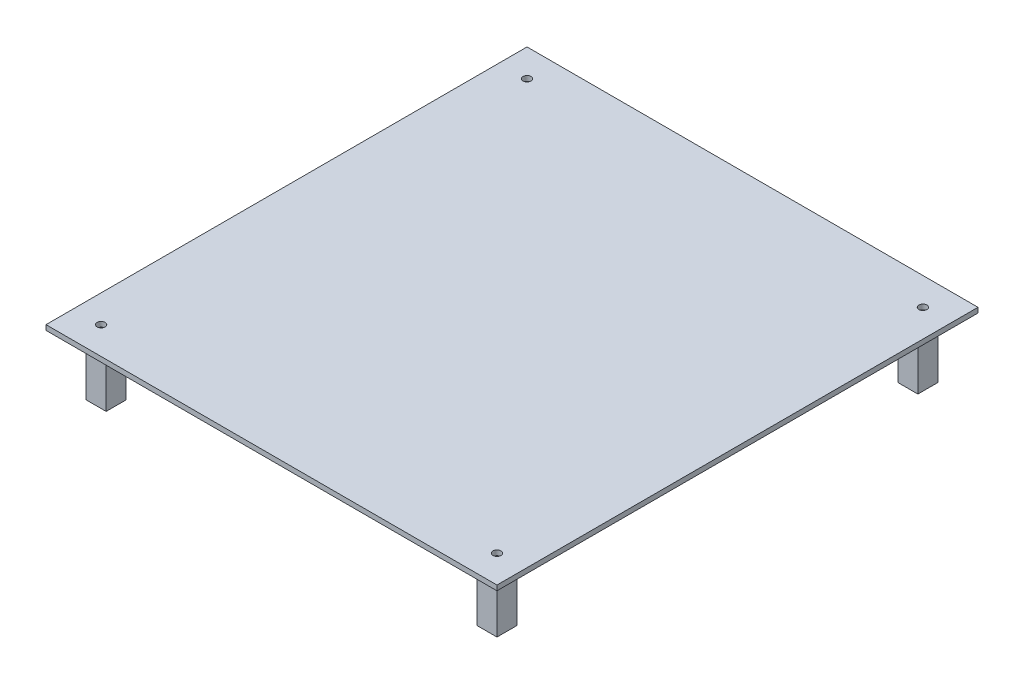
SolidWorks part; units mm, degrees
ref_plane "Front" through (0, 0, 0) normal (0, 0, 1) x (1, 0, 0)
ref_plane "Top" through (0, 0, 0) normal (0, 1, 0) x (1, 0, 0)
ref_plane "Right" through (0, 0, 0) normal (1, 0, 0) x (0, 0, -1)
sketch "Sketch1" plane through (0, 0, 0) normal (0, 1, 0) x (1, 0, 0)
  line L1 (-571.5, -609.6) -> (571.5, -609.6)
  line L2 (-571.5, -609.6) -> (-571.5, 609.6)
  line L3 (-571.5, 609.6) -> (571.5, 609.6)
  line L4 (571.5, -609.6) -> (571.5, 609.6)
  line L5 (-571.5, -609.6) -> (571.5, 609.6) construction
  line L6 (-571.5, 609.6) -> (571.5, -609.6) construction
  point P0 (0, 0)
  dimension "D1" = 1143
  dimension "D2" = 1219.2
extrude "Boss-Extrude1" add sketch "Sketch1" along normal blind 12.7
sketch "Sketch3" plane through (0, 0, 0) normal (0, 0, 1) x (1, 0, 0)
  line L0 (-571.5, 0) -> (571.5, 0) construction
  line L1 (-571.5, 0) -> (-469.9, 0)
  line L2 (-571.5, 0) -> (-571.5, -101.6)
  line L3 (-571.5, -101.6) -> (-469.9, -101.6)
  line L4 (-469.9, 0) -> (-469.9, -101.6)
  line L5 (-565.15, -6.35) -> (-476.25, -6.35)
  line L6 (-565.15, -6.35) -> (-565.15, -95.25)
  line L7 (-565.15, -95.25) -> (-476.25, -95.25)
  line L8 (-476.25, -6.35) -> (-476.25, -95.25)
  line L9 (-50.8, 0) -> (50.8, 0)
  line L10 (-50.8, 0) -> (-50.8, -101.6)
  line L11 (-50.8, -101.6) -> (50.8, -101.6)
  line L12 (50.8, 0) -> (50.8, -101.6)
  line L14 (-44.45, -6.35) -> (44.45, -6.35)
  line L15 (-44.45, -6.35) -> (-44.45, -95.25)
  line L16 (-44.45, -95.25) -> (44.45, -95.25)
  line L17 (44.45, -6.35) -> (44.45, -95.25)
  line L18 (571.5, 0) -> (469.9, 0)
  line L19 (571.5, 0) -> (571.5, -101.6)
  line L20 (571.5, -101.6) -> (469.9, -101.6)
  line L21 (469.9, 0) -> (469.9, -101.6)
  line L22 (476.25, -6.35) -> (565.15, -6.35)
  line L23 (476.25, -6.35) -> (476.25, -95.25)
  line L24 (476.25, -95.25) -> (565.15, -95.25)
  line L25 (565.15, -6.35) -> (565.15, -95.25)
  point P29 (-565.15, -50.8)
  point P30 (-571.5, -50.8)
  point P31 (-520.7, -95.25)
  point P32 (-520.7, -101.6)
  point P33 (0, -101.6)
  point P35 (0, -95.25)
  point P36 (520.7, -95.25)
  point P37 (520.7, -101.6)
  dimension "D1" = 101.6
  dimension "D2" = 6.35
  dimension "D3" = 6.35
extrude "Boss-Extrude2" [suppressed] add sketch "Sketch3" along normal up to vertex and the other way up to vertex separate body
hole_wizard "3/4 Clearance Hole1" positions "Sketch5" profile "Sketch6" hole size "3/4" standard "ANSI Inch"
sketch "Sketch5" plane through (0, 0, 0) normal (0, 1, 0) x (1, 0, 0)
  line L1 (-501.65, -539.75) -> (501.65, -539.75) construction
  line L2 (-501.65, -539.75) -> (-501.65, 539.75) construction
  line L3 (-501.65, 539.75) -> (501.65, 539.75) construction
  line L4 (501.65, -539.75) -> (501.65, 539.75) construction
  line L5 (-501.65, -539.75) -> (501.65, 539.75) construction
  line L6 (-501.65, 539.75) -> (501.65, -539.75) construction
  point P1 (501.65, 539.75)
  point P120 (-501.65, -539.75)
  point P121 (-501.65, 539.75)
  point P122 (501.65, -539.75)
  point P127 (0, 0)
  dimension "D1" = 1079.5
  dimension "D2" = 1003.3
sketch "Sketch6" plane through (501.65, 0, -539.75) normal (1, 0, 0) x (0, 0, -1)
  line L0 (0, 0) -> (0, 12.7)
  line L1 (0, 12.7) -> (10.1206, 12.7)
  line L2 (10.1206, 12.7) -> (10.1206, 0)
  line L5 (10.1206, 0) -> (0, 0)
  line L11 (0, -6.35) -> (0, 107.95) construction
  dimension "Thru Hole Dia." = 20.2413
  dimension "Thru Hole Depth" = 12.7
sketch "Sketch7" plane through (0, 0, 0) normal (0, 1, 0) x (1, 0, 0)
  line L9 (-520.7, 558.8) -> (-469.9, 558.8)
  line L10 (-520.7, 558.8) -> (-520.7, 508)
  line L11 (-520.7, 508) -> (-469.9, 508)
  line L12 (-469.9, 558.8) -> (-469.9, 508)
  line L17 (-517.525, 555.625) -> (-473.075, 555.625)
  line L18 (-517.525, 555.625) -> (-517.525, 511.175)
  line L19 (-517.525, 511.175) -> (-473.075, 511.175)
  line L20 (-473.075, 555.625) -> (-473.075, 511.175)
  point P0 (-495.3, 555.625)
  point P1 (-495.3, 558.8)
  point P2 (-517.525, 533.4)
  point P3 (-520.7, 533.4)
  point P4 (-387.4978, 478.6345)
  dimension "D1" = 50.8
  dimension "D2" = 3.175
  dimension "D3" = 3.175
  dimension "D4" = 558.8
  dimension "D5" = 520.7
extrude "Boss-Extrude3" add sketch "Sketch7" against normal blind 152.4 separate body
mirror "Mirror2" about plane through (0, 0, 0) normal (1, 0, 0)
